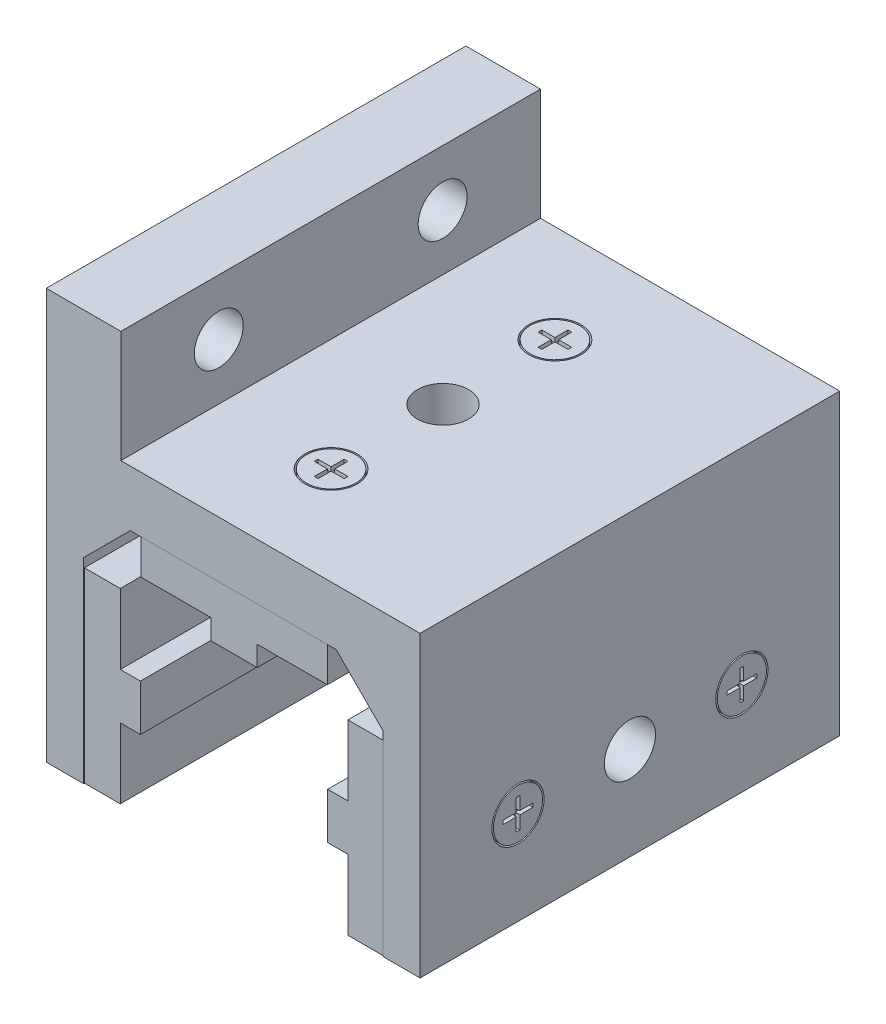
SolidWorks part; units mm, degrees
ref_plane "Front" through (0, 0, 0) normal (0, 0, 1) x (1, 0, 0)
ref_plane "Top" through (0, 0, 0) normal (0, 1, 0) x (1, 0, 0)
ref_plane "Right" through (0, 0, 0) normal (1, 0, 0) x (0, 0, -1)
sketch "Sketch1" plane through (0, 0, 0) normal (0, 0, 1) x (1, 0, 0)
  line L0 (-25.4635, 0) -> (-25.4635, 33.3248)
  line L1 (-31.8135, 50.8) -> (31.8135, 50.8)
  line L2 (-31.8135, 50.8) -> (-31.8135, 0)
  line L3 (-31.8135, 0) -> (-25.4635, 0)
  line L4 (31.8135, 50.8) -> (31.8135, 0)
  line L5 (-25.4635, 33.3248) -> (-17.5133, 41.275)
  line L6 (-17.5133, 41.275) -> (17.5133, 41.275)
  line L7 (17.5133, 41.275) -> (25.4635, 33.3248)
  line L8 (25.4635, 33.3248) -> (25.4635, 0)
  line L9 (25.4635, 0) -> (31.8135, 0)
  line L11 (-25.4635, 0) -> (25.4635, 0) construction
  dimension "Ht" = 50.8
  dimension "Base Wd" = 63.627
  dimension "D2" = 45
  dimension "Leg Thick" = 6.35
  dimension "Top Thick" = 9.525
  dimension "Peak Wd" = 35.0266
extrude "Boss-Extrude1" add sketch "Sketch1" along normal mid plane 71.4248
sketch "Sketch2" plane through (0, 0, 0) normal (0, 0, 1) x (1, 0, 0)
  line L0 (-19.3675, 19.812) -> (-19.3675, 31.75)
  line L1 (-25.4635, 0) -> (-19.3675, 0)
  line L2 (-25.4635, 0) -> (-25.4635, 31.75)
  line L3 (-25.4635, 31.75) -> (-19.3675, 31.75)
  line L4 (-19.3675, 0) -> (-19.3675, 11.938)
  line L5 (-19.3675, 19.812) -> (-15.9385, 19.812)
  line L7 (-19.3675, 11.938) -> (-15.9385, 11.938)
  line L8 (-15.9385, 19.812) -> (-15.9385, 11.938)
  line L12 (-17.5133, 41.275) -> (17.5133, 41.275) construction
  line L13 (-15.875, 41.275) -> (15.875, 41.275)
  line L14 (-15.875, 41.275) -> (-15.875, 35.179)
  line L15 (-15.875, 35.179) -> (-3.937, 35.179)
  line L16 (15.875, 41.275) -> (15.875, 35.179)
  line L17 (3.937, 35.179) -> (15.875, 35.179)
  line L19 (-3.937, 35.179) -> (-3.937, 31.75)
  line L20 (-3.937, 31.75) -> (3.937, 31.75)
  line L21 (3.937, 35.179) -> (3.937, 31.75)
  point P14 (-15.9385, 15.875)
  point P28 (0, 41.275)
  dimension "Pad Wd" = 31.75
  dimension "Pad Thick 1" = 9.525
  dimension "Pad Thick 2" = 6.096
  dimension "Pad Nose" = 7.874
extrude "Boss-Extrude2" add sketch "Sketch2" along normal mid plane 71.12 separate body
sketch "Sketch11" plane through (-15.9385, 0, 0) normal (1, 0, 0) x (0, 0, -1)
  line L0 (-35.56, 19.812) -> (35.56, 19.812) construction
  line L1 (-3.937, 19.812) -> (3.937, 19.812)
  line L2 (-3.937, 19.812) -> (-3.937, 11.938)
  line L3 (-3.937, 11.938) -> (3.937, 11.938)
  line L4 (3.937, 19.812) -> (3.937, 11.938)
  line L5 (-35.56, 11.938) -> (35.56, 11.938) construction
  point P8 (0, 19.812)
extrude "Cut-Extrude5" cut sketch "Sketch11" against normal through all
sketch "Sketch12" plane through (0, 31.75, 0) normal (0, -1, 0) x (1, 0, 0)
  line L0 (-3.937, 35.56) -> (-3.937, -35.56) construction
  line L1 (-3.937, 3.937) -> (3.937, 3.937)
  line L2 (-3.937, 3.937) -> (-3.937, -3.937)
  line L3 (-3.937, -3.937) -> (3.937, -3.937)
  line L4 (3.937, 3.937) -> (3.937, -3.937)
  line L5 (3.937, 35.56) -> (3.937, -35.56) construction
  point P8 (-3.937, 0)
extrude "Cut-Extrude6" cut sketch "Sketch12" against normal through all
mirror "Mirror1" about plane through (0, 0, 0) normal (1, 0, 0)
sketch "Sketch3" plane through (0, 50.8, 0) normal (0, 1, 0) x (1, 0, 0)
  line L0 (0, -19.05) -> (0, 19.05) construction
  circle A0 centre (0, -19.05) radius 4.445
  circle A1 centre (0, -19.05) radius 4.191
  dimension "D1" = 0.254
  dimension "Screw Head Dia" = 8.89
  dimension "Screw Spacing" = 38.1
extrude "Cut-Extrude1" cut sketch "Sketch3" against normal blind 4.7625
sketch "Sketch5" plane through (0, 50.8, 0) normal (0, 1, 0) x (1, 0, 0)
  line L0 (0.3175, -18.7325) -> (2.54, -18.7325)
  line L1 (-0.3175, -16.51) -> (0.3175, -16.51)
  line L2 (-0.3175, -16.51) -> (-0.3175, -18.7325)
  line L3 (-0.3175, -21.59) -> (0.3175, -21.59)
  line L4 (0.3175, -16.51) -> (0.3175, -18.7325)
  line L5 (-2.54, -18.7325) -> (-0.3175, -18.7325)
  line L6 (-2.54, -18.7325) -> (-2.54, -19.3675)
  line L7 (-2.54, -19.3675) -> (-0.3175, -19.3675)
  line L8 (2.54, -18.7325) -> (2.54, -19.3675)
  line L9 (-0.3175, -19.3675) -> (-0.3175, -21.59)
  line L10 (0.3175, -19.3675) -> (0.3175, -21.59)
  line L11 (0.3175, -19.3675) -> (2.54, -19.3675)
  line L12 (-0.3175, -18.7325) -> (0.3175, -19.3675) construction
  dimension "D1" = 0.635
  dimension "D2" = 5.08
extrude "Cut-Extrude2" cut sketch "Sketch5" against normal blind 0.762 draft 5
sketch "Sketch13" plane through (31.8135, 0, 0) normal (1, 0, 0) x (0, 0, -1)
  circle A0 centre (-19.05, 15.875) radius 4.445
  dimension "D1" = 8.89
extrude "Cut-Extrude-Thin1" cut sketch "Sketch13" against normal blind 3.175 thin
sketch "Sketch14" plane through (31.8135, 0, 0) normal (1, 0, 0) x (0, 0, -1)
  line L0 (-19.3675, 15.5575) -> (-19.3675, 13.335)
  line L1 (-19.3675, 18.415) -> (-18.7325, 18.415)
  line L2 (-19.3675, 18.415) -> (-19.3675, 16.1925)
  line L3 (-19.3675, 13.335) -> (-18.7325, 13.335)
  line L4 (-18.7325, 18.415) -> (-18.7325, 16.1925)
  line L5 (-21.59, 16.1925) -> (-19.3675, 16.1925)
  line L6 (-21.59, 16.1925) -> (-21.59, 15.5575)
  line L7 (-21.59, 15.5575) -> (-19.3675, 15.5575)
  line L8 (-16.51, 16.1925) -> (-16.51, 15.5575)
  line L9 (-18.7325, 16.1925) -> (-16.51, 16.1925)
  line L10 (-18.7325, 15.5575) -> (-18.7325, 13.335)
  line L11 (-18.7325, 15.5575) -> (-16.51, 15.5575)
  line L12 (-19.3675, 16.1925) -> (-18.7325, 15.5575) construction
  dimension "D1" = 0.635
  dimension "D2" = 5.08
extrude "Cut-Extrude7" cut sketch "Sketch14" against normal blind 0.762 draft 5
mirror "Mirror4" about plane through (0, 0, 0) normal (1, 0, 0) of "Cut-Extrude7", "Cut-Extrude-Thin1"
mirror "Mirror3" about plane through (0, 0, 0) normal (0, 0, 1) of "Mirror4", "Cut-Extrude-Thin1", "Cut-Extrude7", "Cut-Extrude1", "Cut-Extrude2"
sketch "Sketch9" plane through (0, 50.8, 0) normal (0, 1, 0) x (1, 0, 0)
  circle A0 centre (0, 0) radius 4.3561
  dimension "Top Hole Dia" = 8.7122
extrude "Cut-Extrude4" cut sketch "Sketch9" against normal through all
sketch "Sketch15" plane through (0, 0, 0) normal (1, 0, 0) x (0, 0, -1)
  circle A0 centre (0, 15.875) radius 4.3561
  dimension "Side Wall Hole Dia" = 8.7122
extrude "Cut-Extrude8" cut sketch "Sketch15" against normal through all and the other way through all
sketch "Sketch6" plane through (0, 0, 0) normal (0, 0, 1) x (1, 0, 0)
  line L0 (-31.8135, 0) -> (-25.4635, 0) construction
  line L1 (-31.8135, 41.275) -> (-19.1135, 41.275)
  line L2 (-31.8135, 41.275) -> (-31.8135, 69.85)
  line L3 (-31.8135, 69.85) -> (-19.1135, 69.85)
  line L4 (-19.1135, 41.275) -> (-19.1135, 69.85)
  line L5 (-17.5133, 41.275) -> (17.5133, 41.275) construction
  line L6 (-31.8135, 50.8) -> (-31.8135, 0) construction
  dimension "Oall Ht" = 69.85
  dimension "Side Flange Thickness" = 12.7
extrude "Side Flange" add sketch "Sketch6" along normal up to surface and the other way up to surface
sketch "Sketch7" plane through (0, 0, 0) normal (1, 0, 0) x (0, 0, -1)
  line L0 (-19.05, 60.325) -> (19.05, 60.325) construction
  line L2 (-35.7124, 0) -> (35.7124, 0) construction
  line L3 (-19.05, 46.0375) -> (-19.05, 50.8) construction
  circle A0 centre (-19.05, 60.325) radius 4.1656
  circle A1 centre (19.05, 60.325) radius 4.1656
  point P4 (0, 60.325)
  dimension "Side Flange Hole Dia" = 8.3312
  dimension "Side Flange Hole Spacing" = 60.325
extrude "Side Flange Hole" cut sketch "Sketch7" against normal through all
sketch "Sketch16" plane through (0, 0, 0) normal (0, 0, 1) x (1, 0, 0)
  line L1 (-31.8135, 50.8) -> (-28.6385, 50.8)
  line L2 (-31.8135, 50.8) -> (-31.8135, 41.275)
  line L3 (-31.8135, 41.275) -> (-28.6385, 41.275)
  line L4 (-28.6385, 50.8) -> (-28.6385, 41.275)
  line L5 (31.8135, 50.8) -> (-19.1135, 50.8) construction
  line L6 (28.6385, 50.8) -> (31.8135, 50.8)
  line L7 (28.6385, 50.8) -> (28.6385, 41.275)
  line L8 (28.6385, 41.275) -> (31.8135, 41.275)
  line L9 (31.8135, 50.8) -> (31.8135, 41.275)
  line L10 (-31.8135, 0) -> (-25.4635, 0) construction
  line L11 (25.4635, 0) -> (31.8135, 0) construction
  point P4 (-28.6385, 0)
  point P13 (28.6385, 0)
  dimension "Oall Wd" = 63.627
  dimension "Top Flange Thickness" = 9.525
extrude "Top Flange" add sketch "Sketch16" along normal up to surface (35.7124 mm away) and the other way up to surface (35.7124 mm away)
sketch "Sketch17" plane through (0, 50.8, 0) normal (0, 1, 0) x (1, 0, 0)
  line L0 (-41.275, 19.05) -> (41.275, -19.05) construction
  line L1 (-41.275, 19.05) -> (41.275, 19.05) construction
  line L2 (-41.275, 19.05) -> (-41.275, -19.05) construction
  line L3 (-41.275, -19.05) -> (41.275, -19.05) construction
  line L4 (41.275, 19.05) -> (41.275, -19.05) construction
  line L5 (-28.6385, 19.05) -> (-31.8135, 19.05) construction
  circle A0 centre (41.275, 19.05) radius 4.1656
  circle A1 centre (41.275, -19.05) radius 4.1656
  circle A2 centre (-41.275, 19.05) radius 4.1656
  circle A3 centre (-41.275, -19.05) radius 4.1656
  dimension "Top Flange Hole Dia" = 8.3312
  dimension "Top Flange Hole Spacing" = 82.55
extrude "Top Flange Hole" [suppressed] cut sketch "Sketch17" against normal through all
mirror "Mirror7" [suppressed]
mirror "Mirror6" [suppressed]
other "Delete Hole Short" [suppressed]
other "Delete Hole Long" [suppressed]
equation "\"D1@Cut-Extrude1\" = \"Top Thick@Sketch1\" * .5"
equation "\"D1@Sketch13\" = \"Screw Head Dia@Sketch3\""
equation "\"D1@Cut-Extrude-Thin1\" = \"Leg Thick@Sketch1\" * .5"
equation "\"D5@Cut-Extrude-Thin1\" = \"D1@Sketch3\""
equation "\"D1@Cut-Extrude7\" = \"D1@Cut-Extrude2\""
equation "\"D1@Sketch14\" = \"D1@Sketch5\""
equation "\"D2@Sketch14\" = \"D2@Sketch5\""
equation "\"D3@Cut-Extrude7\" = \"D3@Cut-Extrude2\""
